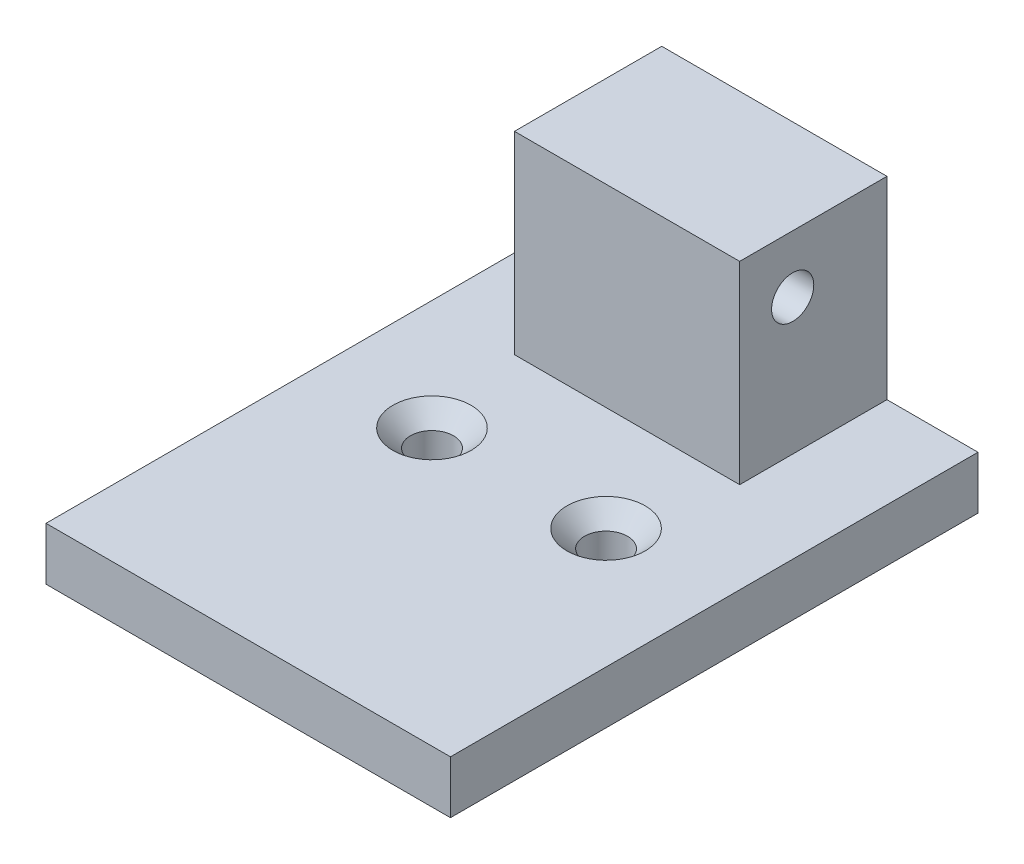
SolidWorks part; units mm, degrees
ref_plane "Спереди" through (0, 0, 0) normal (0, 0, 1) x (1, 0, 0)
ref_plane "Сверху" through (0, 0, 0) normal (0, 1, 0) x (1, 0, 0)
ref_plane "Справа" through (0, 0, 0) normal (1, 0, 0) x (0, 0, -1)
sketch "Эскиз1" plane through (0, 0, 0) normal (0, 1, 0) x (1, 0, 0)
  line L1 (-38.7766, 28.24) -> (-15.7766, 28.24)
  line L2 (-38.7766, 28.24) -> (-38.7766, 14.6977)
  line L3 (-38.7766, 14.6977) -> (-15.7766, 14.6977)
  line L4 (-15.7766, 28.24) -> (-15.7766, 14.6977)
  line L5 (-38.7636, 14.3253) -> (-15.7636, 14.3253)
  line L6 (-38.7636, 14.3253) -> (-38.7636, -15.6747)
  line L7 (-38.7636, -15.6747) -> (-15.7636, -15.6747)
  line L8 (-15.7636, 14.3253) -> (-15.7636, -15.6747)
  circle A0 centre (-22.5896, 0) radius 1.2251
  circle A1 centre (-32.4896, 0) radius 1.2251
  circle A2 centre (-22.5896, 18.6) radius 1.2251
  circle A3 centre (-32.4896, 18.6) radius 1.2251
  dimension "D1" = 9.9
  dimension "D2" = 18.6
  dimension "D3" = 18.6
  dimension "D4" = 30
  dimension "D5" = 23
  dimension "D6" = 23
extrude "Бобышка-Вытянуть1" add sketch "Эскиз1" along normal blind 3
chamfer "Фаска1" distance 1 angle 45 2 edges at (-22.5896, 3, -17.3749) (-32.4896, 3, -17.3749)
chamfer "Фаска2" distance 1 angle 45 2 edges at (-22.5896, 3, 1.2251) (-32.4896, 3, 1.2251)
sketch "Эскиз3" plane through (0, 3, 0) normal (0, 1, 0) x (1, 0, 0)
  line L0 (-38.7766, 14.6977) -> (-15.7766, 14.6977) construction
  line L1 (-24.8199, 14.6977) -> (-30.1221, 14.6977)
  line L2 (-24.8199, 14.6977) -> (-24.8199, 21.6712)
  line L3 (-24.8199, 21.6712) -> (-30.1221, 21.6712)
  line L4 (-30.1221, 14.6977) -> (-30.1221, 21.6712)
extrude "Бобышка-Вытянуть2" add sketch "Эскиз3" along normal blind 10
sketch "Эскиз4" plane through (0, 0, -21.6712) normal (0, 0, -1) x (-1, 0, 0)
  line L0 (30.1221, 13) -> (30.1221, 3) construction
  line L1 (24.8199, 13) -> (30.1221, 13)
  line L2 (24.8199, 13) -> (24.8199, 9.2177)
  line L3 (24.8199, 9.2177) -> (30.1221, 9.2177)
  line L4 (30.1221, 13) -> (30.1221, 9.2177)
extrude "Бобышка-Вытянуть3" add sketch "Эскиз4" along normal blind 3
draft "Уклон2" type of draft neutral plane draft angle 30 faces to draft 1 parameters "D1"=30
sketch "Эскиз5" plane through (0, 3, 0) normal (0, 1, 0) x (1, 0, 0)
  line L0 (-15.7636, 14.3253) -> (-38.7636, 14.3253) construction
  line L1 (-34.4485, 14.3253) -> (-20.2405, 14.3253)
  line L2 (-34.4485, 14.3253) -> (-34.4485, 2.9491)
  line L3 (-34.4485, 2.9491) -> (-20.2405, 2.9491)
  line L4 (-20.2405, 14.3253) -> (-20.2405, 2.9491)
extrude "Бобышка-Вытянуть4" add sketch "Эскиз5" along normal blind 11
sketch "Эскиз6" plane through (-34.4485, 0, 0) normal (-1, 0, 0) x (0, 0, 1)
  circle A0 centre (-8.9626, 10.7326) radius 1.2
extrude "Вырез-Вытянуть1" cut sketch "Эскиз6" against normal blind 26
sketch "Эскиз10" plane through (0, 0, -2.9491) normal (0, 0, 1) x (1, 0, 0)
  line L1 (-20.2405, 3) -> (-34.4485, 3)
  line L2 (-20.2405, 3) -> (-20.2405, 14)
  line L3 (-20.2405, 14) -> (-34.4485, 14)
  line L4 (-34.4485, 3) -> (-34.4485, 14)
extrude "Вырез-Вытянуть2" cut sketch "Эскиз10" against normal blind 3
sketch "Эскиз11" plane through (-34.4485, 0, 0) normal (-1, 0, 0) x (0, 0, 1)
  line L1 (-14.3253, 3) -> (-5.9491, 3)
  line L2 (-14.3253, 3) -> (-14.3253, 14)
  line L3 (-14.3253, 14) -> (-5.9491, 14)
  line L4 (-5.9491, 3) -> (-5.9491, 14)
extrude "Вырез-Вытянуть4" cut sketch "Эскиз11" against normal blind 0.7
sketch "Эскиз14" plane through (-20.2405, 0, 0) normal (1, 0, 0) x (0, 0, -1)
  line L0 (5.9491, 14) -> (14.3253, 14) construction
  line L1 (14.3253, 3) -> (5.9491, 3)
  line L2 (14.3253, 3) -> (14.3253, 14)
  line L3 (14.3253, 14) -> (5.9491, 14)
  line L4 (5.9491, 3) -> (5.9491, 14)
extrude "Вырез-Вытянуть5" cut sketch "Эскиз14" against normal blind 0.7
delete or keep bodies "Тело-Удалить/Сохранить 1" type delete bodies bodies 112
